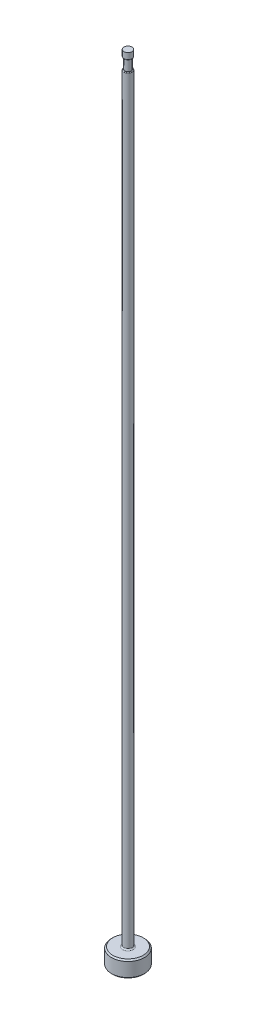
SolidWorks part; units mm, degrees
ref_plane "Front Plane" through (0, 0, 0) normal (0, 0, 1) x (1, 0, 0)
ref_plane "Top Plane" through (0, 0, 0) normal (0, 1, 0) x (1, 0, 0)
ref_plane "Right Plane" through (0, 0, 0) normal (1, 0, 0) x (0, 0, -1)
other "Configuration Table"
sketch "Sketch1" plane through (0, 0, 0) normal (0, 0, 1) x (1, 0, 0)
  line L0 (0, 259.9588) -> (0, -15.1925) construction
  line L1 (0, 0) -> (-3.175, 0)
  line L2 (-3.175, 0) -> (-3.175, 3.175)
  line L3 (-3.175, 3.175) -> (-0.7937, 3.175)
  line L4 (-0.7937, 3.175) -> (-0.7937, 152.4)
  line L5 (-0.7937, 152.4) -> (0, 152.4)
  line L6 (0, 152.4) -> (0, 0)
  dimension "L" = 152.4
  dimension "H" = 6.35
  dimension "T" = 3.175
  dimension "D" = 1.5875
revolve "Revolve1" add sketch "Sketch1" angle 360 about L0
chamfer "Chamfer1" distance 0.254 angle 45 2 edges at (0, 3.175, 3.175) (0, 0, 3.175)
fillet "Fillet1" radius 0.254 1 edges at (0, 3.175, 0.7937)
sketch "Sketch2" plane through (0, 0, 0) normal (0, 0, 1) x (1, 0, 0)
  line L0 (-0.7937, 152.4) -> (-0.7937, 3.429) construction
  line L1 (-0.7937, 151.13) -> (-0.5905, 151.13)
  line L2 (-0.7937, 151.13) -> (-0.7937, 149.098)
  line L3 (-0.7937, 149.098) -> (-0.5905, 149.098)
  line L4 (-0.5905, 151.13) -> (-0.5905, 149.098)
  line L5 (0.7937, 152.4) -> (-0.7937, 152.4) construction
  line L6 (0, 153.4483) -> (0, 147.3282) construction
  dimension "D1" = 2.032
  dimension "N" = 1.27
  dimension "FD" = 0.2032
  dimension "D3" = 1.1811
revolve "Vent Relief" cut sketch "Sketch2" angle 360 about L6
sketch "Sketch3" plane through (0, 0, 0) normal (0, 0, 1) x (1, 0, 0)
  line L0 (-0.5905, 150.114) -> (-0.5905, 86.614)
  line L1 (-0.5905, 151.13) -> (-0.5905, 149.098) construction
  line L2 (-0.7937, 149.098) -> (-0.7937, 3.429) construction
  line L3 (-0.7937, 85.4964) -> (-0.7937, 150.114)
  line L4 (-0.7937, 150.114) -> (-0.5905, 150.114)
  arc A0 (-0.5905, 86.614) -> (-0.7937, 85.4964) centre (-3.7655, 86.614) cw
  dimension "D1" = 3.175
  dimension "D2" = 63.5
extrude "D-Slot" cut sketch "Sketch3" against normal through all both and the other way through all
sketch "Sketch5" plane through (0, 0, 0) normal (0, 0, 1) x (1, 0, 0)
  line L0 (-0.7937, 151.13) -> (0.7937, 151.13) construction
  line L1 (-0.7937, 152.4) -> (-0.781, 152.4)
  line L2 (-0.7937, 152.4) -> (-0.7937, 151.13)
  line L3 (-0.7937, 151.13) -> (-0.781, 151.13)
  line L4 (-0.781, 152.4) -> (-0.781, 151.13)
  line L5 (0, 152.6877) -> (0, 150.5771) construction
  dimension "VP" = 0.0127
revolve "Vent Diameter" cut sketch "Sketch5" angle 360 about L5
fillet "Fillet2" radius 0.127 2 edges at (0.7937, 149.098, 0) (0, 151.13, 0.781)
sketch "Pocket Sketch" plane through (0, 0, 0) normal (0, 0, 1) x (1, 0, 0)
  line L0 (-3.5719, 0) -> (-3.5719, 3.2004)
  line L1 (-3.5719, 3.2004) -> (-1.7542, 3.2004)
  line L2 (-0.9922, 3.9624) -> (-0.9922, 22.225)
  line L3 (-0.9922, 22.225) -> (0, 22.225)
  line L4 (0, 22.225) -> (0, 0)
  line L5 (0, 0) -> (-3.5719, 0)
  line L6 (0, 12.6104) -> (0, -2.4989) construction
  line L7 (-3.175, 2.921) -> (-3.175, 0.254) construction
  line L8 (2.921, 3.175) -> (-2.921, 3.175) construction
  line L9 (-0.7937, 85.4964) -> (-0.7937, 3.429) construction
  line L10 (-1.7542, 3.2004) -> (-0.9922, 3.9624)
  point P3 (-0.9922, 3.2004)
  dimension "D1" = 7.1437
  dimension "D2" = 0.3969
  dimension "D3" = 0.0254
  dimension "D4" = 0.1984
  dimension "D5" = 1.9844
  dimension "D6" = 22.225
